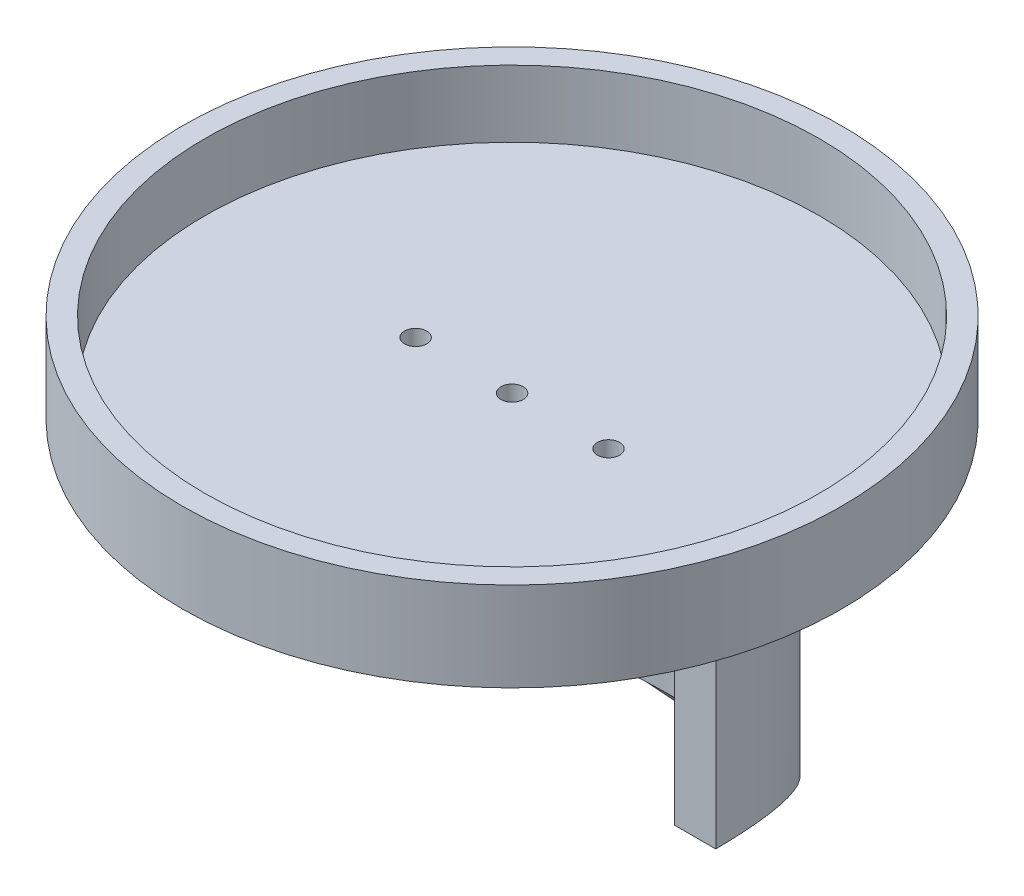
SolidWorks part; units mm, degrees
ref_plane "Front Plane" through (0, 0, 0) normal (0, 0, 1) x (1, 0, 0)
ref_plane "Top Plane" through (0, 0, 0) normal (0, 1, 0) x (1, 0, 0)
ref_plane "Right Plane" through (0, 0, 0) normal (1, 0, 0) x (0, 0, -1)
sketch "Sketch1" plane through (0, 0, 0) normal (0, 1, 0) x (1, 0, 0)
  circle A0 centre (-36.5085, 35.0226) radius 74
  dimension "D1" = 148
extrude "Boss-Extrude1" add sketch "Sketch1" along normal blind 20
sketch "Sketch3" plane through (0, 0, 0) normal (0, -1, 0) x (-1, 0, 0)
  line L0 (-9.2311, 35.0226) -> (0, 35.0226)
  line L1 (73.0169, 35.0226) -> (82.248, 35.0226)
  arc A0 (-9.2311, 35.0226) -> (82.248, 35.0226) centre (36.5085, 35.0226) cw
  arc A2 (0, 35.0226) -> (73.0169, 35.0226) centre (36.5085, 35.0226) cw
extrude "Boss-Extrude2" add sketch "Sketch3" along normal blind 70
sketch "Sketch4" plane through (0, -70, 0) normal (0, -1, 0) x (1, 0, 0)
sketch "Sketch5" plane through (0, -70, 0) normal (0, -1, 0) x (1, 0, 0)
sketch "Sketch6" plane through (0, -70, 0) normal (0, -1, 0) x (1, 0, 0)
  line L2 (9.2311, -35.0226) -> (0, -35.0226)
  line L3 (-73.0169, -35.0226) -> (-82.248, -35.0226)
  line L4 (9.2311, -35.0226) -> (0, -35.0226)
  line L5 (-73.0169, -35.0226) -> (-82.248, -35.0226)
  arc A2 (-82.248, -35.0226) -> (9.2311, -35.0226) centre (-36.5085, -35.0226) ccw
  arc A3 (-73.0169, -35.0226) -> (0, -35.0226) centre (-36.5085, -35.0226) ccw
  arc A4 (-82.248, -35.0226) -> (9.2311, -35.0226) centre (-36.5085, -35.0226) ccw
  arc A5 (-73.0169, -35.0226) -> (0, -35.0226) centre (-36.5085, -35.0226) ccw
  dimension "D1" = 0
extrude "Boss-Extrude3" add sketch "Sketch6" along normal blind 70
hole_wizard "Tap Drill for M6x1.0 Tap1" positions "Sketch11" profile "Sketch12" hole size "M6x1.0" standard "ANSI Metric"
sketch "Sketch11" plane through (0, 0, 0) normal (0, -1, 0) x (-1, 0, 0)
  circle A0 centre (36.5085, 35.0226) radius 74 construction
  point P0 (36.5085, 35.0226)
  point P3 (14.8585, 35.0226)
  point P5 (58.1585, 35.0226)
  dimension "D1" = 0
  dimension "D2" = 21.65
  dimension "D3" = 21.65
sketch "Sketch12" plane through (-36.5085, 0, -35.0226) normal (1, 0, 0) x (0, 0, -1)
  line L0 (0, 0) -> (0, 20)
  line L1 (0, 20) -> (2.5, 20)
  line L2 (2.5, 20) -> (2.5, 0)
  line L5 (2.5, 0) -> (0, 0)
  line L11 (0, -6.35) -> (0, 107.95) construction
  dimension "Thru Hole Dia." = 5
  dimension "Thru Hole Depth" = 20
sketch "Sketch14" plane through (0, 0, 0) normal (1, 0, 0) x (0, 0, -1)
  line L0 (35.0226, -140) -> (35.0226, 0) construction
  line L1 (35.0226, 0) -> (80.7622, 0) construction
  line L3 (35.0226, -113.882) -> (94.6368, -113.882)
  line L4 (35.0226, -113.882) -> (35.0226, -153.6247)
  line L5 (35.0226, -153.6247) -> (94.6368, -153.6247)
  line L6 (94.6368, -113.882) -> (94.6368, -153.6247)
  ellipse E0 centre (35.0226, -100.1249) end of major axis (-15.6111, -101.4624) minor radius 39.3397
  dimension "D1" = 60.7989
  dimension "D2" = 50.6338
extrude "Cut-Extrude7" cut sketch "Sketch14" against normal through all both and the other way through all contours E0 L4 L5 L6 L3 | L4 E0 L3 | L3 E0 L4
sketch "Sketch15" plane through (0, 20, 0) normal (0, 1, 0) x (1, 0, 0)
  circle A0 centre (-36.5085, 35.0226) radius 71.5
extrude "Cut-Extrude8" cut sketch "Sketch15" against normal blind 15
sketch "Sketch16" plane through (0, 5, 0) normal (0, 1, 0) x (1, 0, 0)
  circle A0 centre (-36.5085, 35.0226) radius 69
  circle A3 centre (-36.5085, 35.0226) radius 71.5
extrude "Boss-Extrude6" add sketch "Sketch16" along normal blind 15
sketch "Sketch18" plane through (0, 5, 0) normal (0, 1, 0) x (1, 0, 0)
  circle A0 centre (-36.5085, 35.0226) radius 69
  circle A1 centre (-36.5085, 35.0226) radius 74
extrude "Boss-Extrude7" add sketch "Sketch18" along normal blind 10
sketch "Sketch19" plane through (0, 5, 0) normal (0, 1, 0) x (1, 0, 0)
sketch "Sketch20" plane through (0, 0, 0) normal (0, -1, 0) x (1, 0, 0)
